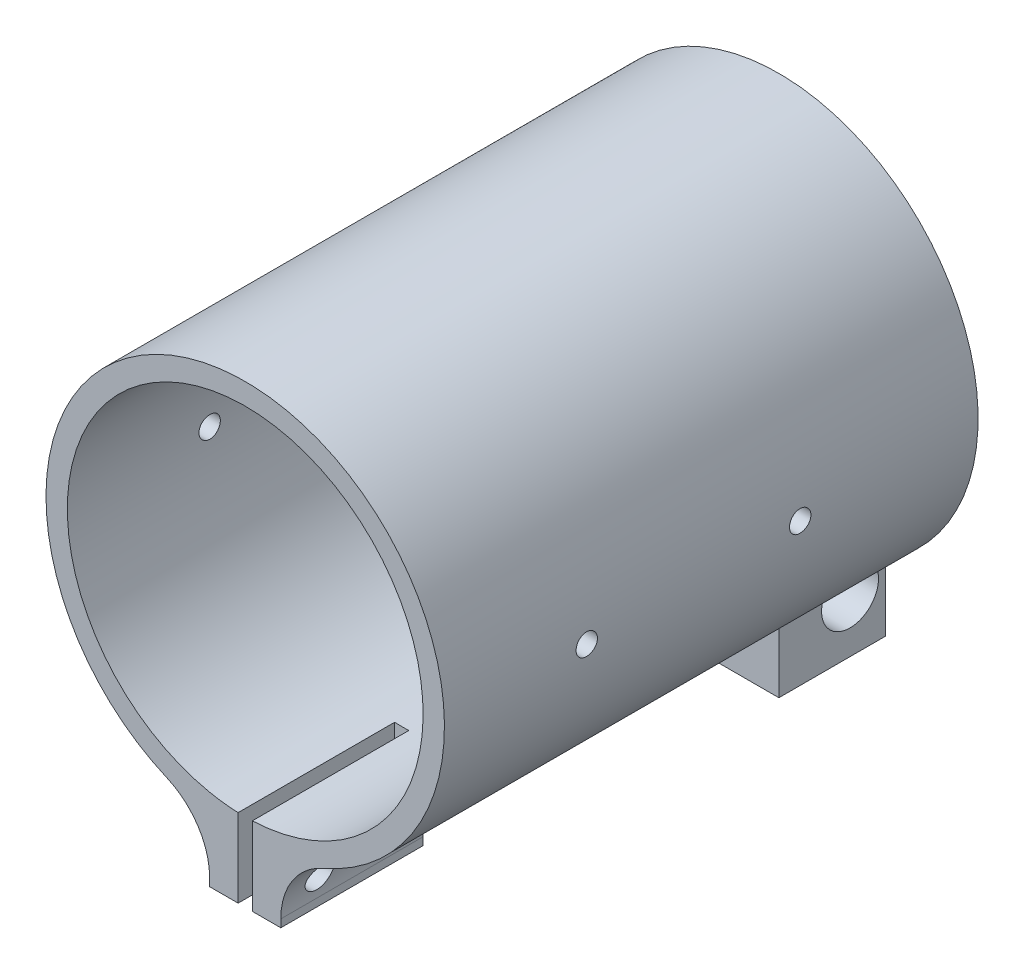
SolidWorks part; units mm, degrees
ref_plane "前视基准面" through (0, 0, 0) normal (0, 0, 1) x (1, 0, 0)
ref_plane "上视基准面" through (0, 0, 0) normal (0, 1, 0) x (1, 0, 0)
ref_plane "右视基准面" through (0, 0, 0) normal (1, 0, 0) x (0, 0, -1)
sketch "草图1" plane through (0, 0, 0) normal (0, 0, 1) x (1, 0, 0)
  circle A0 centre (0, 0) radius 25
  circle A1 centre (0, 0) radius 28
  dimension "D1" = 50
  dimension "D2" = 3
extrude "凸台-拉伸1" add sketch "草图1" along normal blind 75
sketch "草图2" plane through (0, 0, 75) normal (0, 0, 1) x (1, 0, 0)
  line L0 (0, 0) -> (0, -24.5644) construction
  line L1 (4.6467, -24.5644) -> (5, -24.5644)
  line L2 (-5, -36) -> (5, -36)
  line L3 (-5, -36) -> (-5, -24.5644)
  line L4 (-5, -24.5644) -> (-4.6467, -24.5644)
  line L5 (5, -36) -> (5, -24.5644)
  line L6 (-5, -36) -> (5, -24.5644) construction
  line L7 (-5, -24.5644) -> (5, -36) construction
  line L8 (0, -25) -> (0, -37.6741) construction
  circle A2 centre (0, 0) radius 28 construction
  circle A3 centre (0, 0) radius 25 construction
  circle A4 centre (0, 0) radius 25
  point P3 (0, -30.2822)
  dimension "D1" = 8
  dimension "D2" = 10
extrude "凸台-拉伸3" add sketch "草图2" against normal blind 20 contours L2 L5 L3 M5
fillet "圆角1" radius 10 2 edges at (-5, -27.55, 65) (5, -27.55, 65)
sketch "草图3" plane through (0, 0, 75) normal (0, 0, 1) x (1, 0, 0)
  line L1 (-1, -6.0764) -> (1, -6.0764)
  line L2 (-1, -6.0764) -> (-1, -39.4525)
  line L3 (-1, -39.4525) -> (1, -39.4525)
  line L4 (1, -6.0764) -> (1, -39.4525)
  line L5 (-1, -6.0764) -> (1, -39.4525) construction
  line L6 (-1, -39.4525) -> (1, -6.0764) construction
  point P0 (0, -22.7644)
  dimension "D1" = 2
extrude "切除-拉伸1" cut sketch "草图3" against normal blind 22
sketch "草图4" plane through (0, 0, 0) normal (1, 0, 0) x (0, 0, -1)
  line L0 (-75, 28) -> (-75, -25.7262) construction
  line L1 (-75, -25.7262) -> (-75, -34.9142) construction
  circle A0 centre (-70, -31.8241) radius 2
  circle A1 centre (-60, -31.8376) radius 2
  circle A2 centre (-55, 0) radius 1.5
  circle A3 centre (-25, 0) radius 1.5
  dimension "D1" = 30
  dimension "D2" = 20
  dimension "D3" = 3
  dimension "D4" = 3
  dimension "D5" = 4
  dimension "D6" = 4
  dimension "D7" = 10
  dimension "D8" = 5
extrude "切除-拉伸2" cut sketch "草图4" against normal through all both and the other way through all
sketch "草图6" plane through (0, 0, 0) normal (1, 0, 0) x (0, 0, -1)
  line L0 (-53, -28) -> (0, -28) construction
  line L1 (-5, -28) -> (10, -28)
  line L2 (-5, -28) -> (-5, -43)
  line L3 (-5, -43) -> (10, -43)
  line L4 (10, -28) -> (10, -43)
  line L5 (0, -28) -> (0, 28) construction
  line L7 (-5, -28) -> (0, -28)
  line L8 (-5, -28) -> (-5, -23)
  line L9 (-5, -23) -> (0, -23)
  line L10 (0, -28) -> (0, -23)
  circle A0 centre (5, -35.5) radius 4
  dimension "D6" = 8
  dimension "D7" = 5
  dimension "D1" = 5
  dimension "D2" = 5
  dimension "D3" = 10
  dimension "D4" = 15
  dimension "D5" = 7.5
extrude "凸台-拉伸4" add sketch "草图6" along normal mid plane 10 contours L4 L1 L2 L3 A0 | L1 L10 L9 L8
